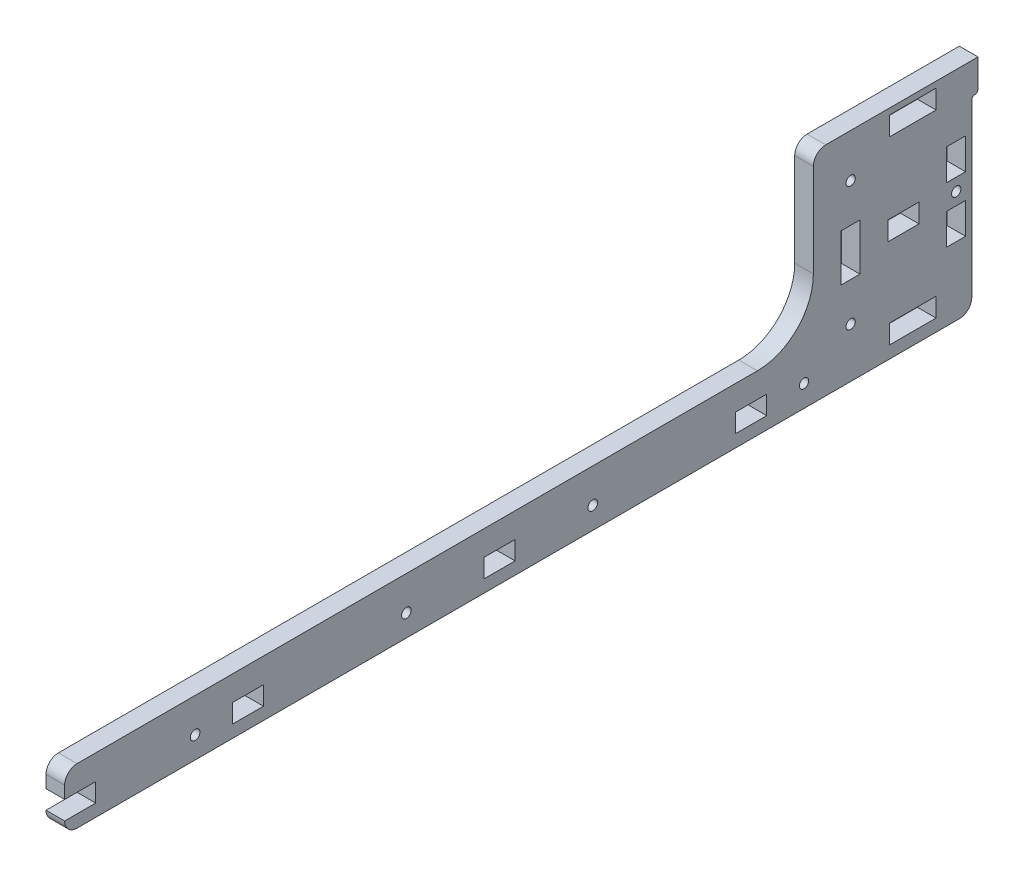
SolidWorks part; units mm, degrees
ref_plane "Спереди" through (0, 0, 0) normal (0, 0, 1) x (1, 0, 0)
ref_plane "Сверху" through (0, 0, 0) normal (0, 1, 0) x (1, 0, 0)
ref_plane "Справа" through (0, 0, 0) normal (1, 0, 0) x (0, 0, -1)
sketch "Эскиз1" plane through (0, 0, 0) normal (1, 0, 0) x (0, 0, -1)
  line L0 (0, 139.2616) -> (0, 0) construction
  line L1 (-292, 0) -> (0, 0)
  line L2 (-69, 18) -> (-292, 18)
  line L3 (-292, 18) -> (-292, 0)
  line L5 (-51, 36) -> (-51, 70)
  line L6 (-51, 70) -> (0, 70)
  line L7 (0, 70) -> (0, 0)
  arc A0 (-69, 18) -> (-51, 36) centre (-69, 36) ccw
  dimension "D3" = 18
  dimension "D2" = 70
  dimension "D4" = 18
  dimension "D5" = 292
  dimension "D10" = 51
extrude "Бобышка-Вытянуть1" add sketch "Эскиз1" along normal blind 6
sketch "Эскиз2" plane through (6, 0, 0) normal (1, 0, 0) x (0, 0, -1)
  line L0 (-54, 7) -> (-39, 7) construction
  line L1 (-292, 0) -> (0, 0) construction
  line L2 (0, 0) -> (0, 70) construction
  line L3 (-292, 0) -> (0, 0) construction
  line L5 (0, 70) -> (-51, 70) construction
  line L6 (0, 36) -> (-39, 36) construction
  line L8 (-39, 70) -> (-39, 0) construction
  circle A0 centre (-39, 16) radius 1.5
  circle A1 centre (-54, 7) radius 1.5
  circle A2 centre (-5, 36) radius 1.5
  circle A6 centre (-39, 56) radius 1.5
  dimension "D2" = 39
  dimension "D3" = 40
  dimension "D4" = 7
  dimension "D5" = 15
  dimension "D6" = 5
  dimension "D1" = 3
  dimension "D8" = 34
extrude "Вырез-Вытянуть1" cut sketch "Эскиз2" against normal through all
sketch "Эскиз7" plane through (6, 0, 0) normal (1, 0, 0) x (0, 0, -1)
  line L0 (0, 36) -> (-86.5891, 36) construction
  line L1 (-2, 22) -> (-2, 32)
  line L2 (-8.1, 50) -> (-2, 50)
  line L3 (-8.1, 50) -> (-8.1, 40)
  line L4 (-8.1, 40) -> (-2, 40)
  line L5 (-2, 50) -> (-2, 40)
  line L6 (-42.1, 43.55) -> (-36, 43.55)
  line L7 (-42.1, 43.55) -> (-42.1, 28.45)
  line L8 (-42.1, 28.45) -> (-36, 28.45)
  line L9 (-36, 43.55) -> (-36, 28.45)
  line L10 (-27, 39.05) -> (-17, 39.05)
  line L11 (-27, 39.05) -> (-27, 32.95)
  line L12 (-27, 32.95) -> (-17, 32.95)
  line L13 (-17, 39.05) -> (-17, 32.95)
  line L14 (-27, 39.05) -> (-17, 32.95) construction
  line L15 (-27, 32.95) -> (-17, 39.05) construction
  line L16 (-8.1, 32) -> (-2, 32)
  line L17 (-8.1, 22) -> (-8.1, 32)
  line L18 (-8.1, 22) -> (-2, 22)
  line L19 (-26.5, 68.05) -> (-11.5, 68.05)
  line L20 (-26.5, 68.05) -> (-26.5, 61.95)
  line L21 (-26.5, 61.95) -> (-11.5, 61.95)
  line L22 (-11.5, 68.05) -> (-11.5, 61.95)
  line L23 (-26.5, 68.05) -> (-11.5, 61.95) construction
  line L24 (-26.5, 61.95) -> (-11.5, 68.05) construction
  line L25 (-26.5, 10.05) -> (-11.5, 3.95) construction
  line L26 (-26.5, 3.95) -> (-11.5, 10.05) construction
  line L27 (-11.5, 3.95) -> (-11.5, 10.05)
  line L28 (-26.5, 10.05) -> (-11.5, 10.05)
  line L29 (-26.5, 3.95) -> (-26.5, 10.05)
  line L30 (-26.5, 3.95) -> (-11.5, 3.95)
  line L31 (0, 0) -> (0, 70) construction
  line L33 (-292, 0) -> (0, 0) construction
  point P2 (-42.1, 36)
  point P11 (-22, 36)
  point P20 (-19, 65)
  point P29 (-19, 7)
  dimension "D1" = 10
  dimension "D2" = 6.1
  dimension "D3" = 14
  dimension "D4" = 6.1
  dimension "D5" = 15.1
  dimension "D6" = 28
  dimension "D7" = 6.1
  dimension "D8" = 15
  dimension "D9" = 2
  dimension "D10" = 58
  dimension "D11" = 19
  dimension "D12" = 22
  dimension "D13" = 36
extrude "Вырез-Вытянуть6" cut sketch "Эскиз7" against normal through all
fillet "Скругление1" radius 4 4 edges at (3, 70, 51) (3, 0, 0) (3, 0, 292) (3, 18, 292)
sketch "Эскиз6" plane through (6, 0, 0) normal (1, 0, 0) x (0, 0, -1)
  line L0 (-292, 14) -> (-292, 4) construction
  line L1 (-292, 10) -> (-282, 10)
  line L2 (-292, 10) -> (-292, 4)
  line L3 (-292, 4) -> (-282, 4)
  line L4 (-282, 10) -> (-282, 4)
  line L5 (-54, 7) -> (-292, 7) construction
  line L7 (-238, 10) -> (-228, 10)
  line L8 (-238, 10) -> (-238, 4)
  line L9 (-238, 4) -> (-228, 4)
  line L10 (-228, 10) -> (-228, 4)
  line L11 (-157, 10) -> (-147, 10)
  line L12 (-157, 10) -> (-157, 4)
  line L13 (-157, 4) -> (-147, 4)
  line L14 (-147, 10) -> (-147, 4)
  line L15 (-76, 10) -> (-66, 10)
  line L16 (-76, 10) -> (-76, 4)
  line L17 (-76, 4) -> (-66, 4)
  line L18 (-66, 10) -> (-66, 4)
  circle A0 centre (-250, 7) radius 1.55
  circle A1 centre (-182, 7) radius 1.55
  circle A2 centre (-122, 7) radius 1.55
  circle A3 centre (-54, 7) radius 1.5 construction
  point P27 (-238, 7)
  dimension "D6" = 68
  dimension "D7" = 60
  dimension "D8" = 3.1
  dimension "D9" = 68
  dimension "D1" = 6
  dimension "D2" = 10
  dimension "D3" = 44
  dimension "D4" = 81
  dimension "D5" = 81
extrude "Вырез-Вытянуть5" cut sketch "Эскиз6" against normal through all
sketch "Эскиз8" plane through (6, 0, 0) normal (1, 0, 0) x (0, 0, -1)
  line L1 (0, 70) -> (2, 70)
  line L2 (0, 70) -> (0, 60)
  line L3 (0, 60) -> (2, 60)
  line L4 (2, 70) -> (2, 60)
  dimension "D1" = 2
  dimension "D2" = 10
extrude "Бобышка-Вытянуть2" add sketch "Эскиз8" against normal up to surface (6 mm away)
fillet "Скругление2" radius 1 2 edges at (3, 60, -2) (3, 60, 0)
